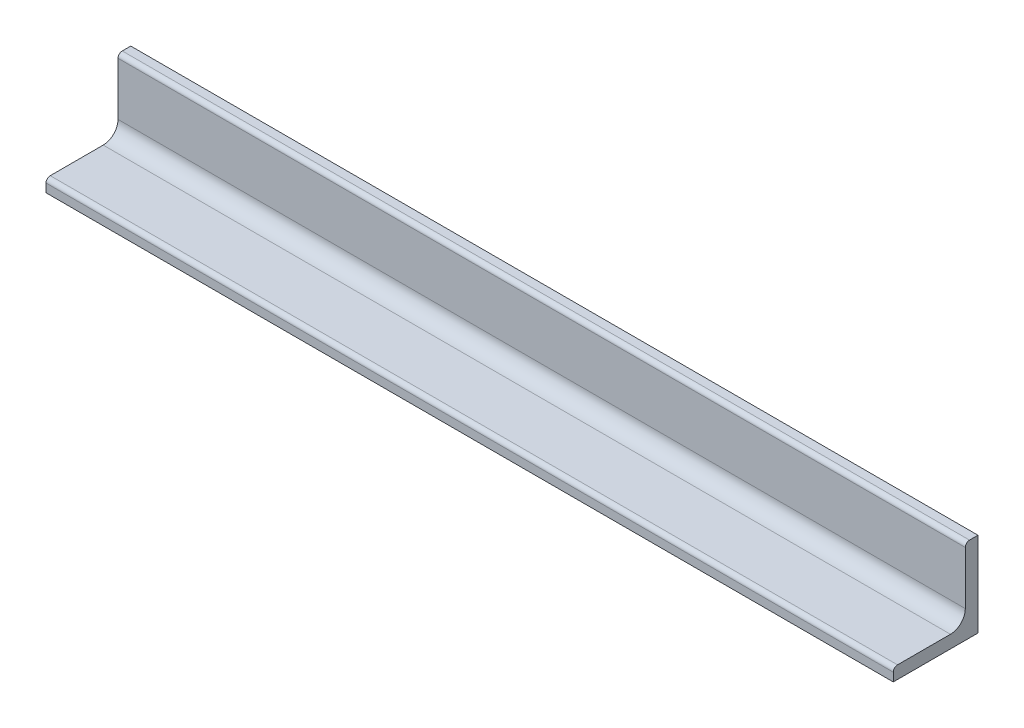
SolidWorks part; units mm, degrees
ref_plane "Front" through (0, 0, 0) normal (0, 0, 1) x (1, 0, 0)
ref_plane "Top" through (0, 0, 0) normal (0, 1, 0) x (1, 0, 0)
ref_plane "Right" through (0, 0, 0) normal (1, 0, 0) x (0, 0, -1)
sketch "Sketch1" plane through (0, 0, 0) normal (1, 0, 0) x (0, 1, 0)
  line L0 (0, 20) -> (0, 0)
  line L1 (0, 0) -> (20, 0)
  line L2 (3, 19) -> (3, 6.5)
  line L3 (6.5, 3) -> (19, 3)
  line L4 (0, 20) -> (2, 20)
  line L5 (20, 0) -> (20, 2)
  arc A0 (2, 20) -> (3, 19) centre (2, 19) cw
  arc A1 (20, 2) -> (19, 3) centre (19, 2) ccw
  arc A2 (3, 6.5) -> (6.5, 3) centre (6.5, 6.5) ccw
  dimension "r1" = 1
  dimension "r" = 3.5
  dimension "b" = 20
  dimension "d1" = 3
  dimension "d" = 3
  dimension "b1" = 20
extrude "Base" add sketch "Sketch1" along normal blind 200
equation "\"r1@Sketch1\" = \"d@Sketch1\" / 3"
equation "\"d1@Sketch1\" = \"d@Sketch1\""
equation "\"b1@Sketch1\" = \"b@Sketch1\""
